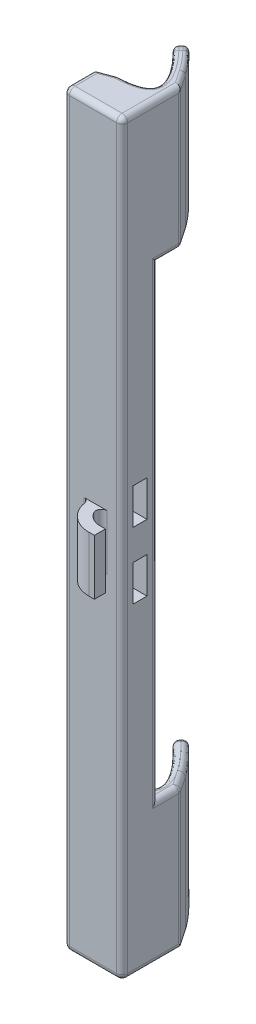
SolidWorks part; units mm, degrees
ref_plane "Front Plane" through (0, 0, 0) normal (0, 0, 1) x (1, 0, 0)
ref_plane "Top Plane" through (0, 0, 0) normal (0, 1, 0) x (1, 0, 0)
ref_plane "Right Plane" through (0, 0, 0) normal (1, 0, 0) x (0, 0, -1)
sketch "Sketch1" plane through (0, 0, 0) normal (0, 1, 0) x (1, 0, 0)
  line L0 (-27.3333, -16.125) -> (-16.8333, -16.125)
  line L1 (-27.3333, -11.625) -> (-27.3333, -16.125) construction
  spline S0 degree 3 poles (-27.3333, -11.625) (-23.339, -11.625) (-16.5111, -11.0911) (-17.6586, -5.246) (-24.4958, 1.1315) knots 0 0 0 0 0.393691 1 1 1 1
  dimension "D1" = 10.5
  dimension "D2" = 4.5
extrude "Extrude-Thin1" add sketch "Sketch1" along normal blind 135 thin contours S0 | L0
ref_plane "Plane1" through (0, 67.5, 0) normal (0, 1, 0) x (1, 0, 0)
sketch "Sketch2" plane through (-27.3333, 0, 0) normal (-1, 0, 0) x (0, 0, 1)
  line L0 (12.625, 135) -> (12.625, 0) construction
  line L1 (12.625, 70.25) -> (15.125, 70.25)
  line L2 (12.625, 70.25) -> (12.625, 64.75)
  line L3 (12.625, 64.75) -> (15.125, 64.75)
  line L4 (15.125, 70.25) -> (15.125, 64.75)
  line L5 (15.125, 135) -> (15.125, 0) construction
  line L6 (15.125, 135) -> (15.125, 0) construction
  line L7 (12.625, 135) -> (12.625, 0) construction
  point P8 (12.625, 67.5)
  dimension "D1" = 5.5
extrude "Boss-Extrude3" add sketch "Sketch2" against normal up to surface (10.5 mm away)
sketch "Sketch5" plane through (0, 0, 0) normal (0, 1, 0) x (1, 0, 0)
  line L0 (-16.8333, -12.625) -> (-27.3333, -12.625) construction
  line L1 (-16.8333, -12.625) -> (-27.3333, -12.625)
  line L3 (-16.8333, -12.625) -> (-16.8333, -6.625)
  line L4 (-18.7549, -3.7789) -> (-16.8333, -6.625)
  spline S0 degree 3 poles (-1814.0444, 892.9965) (-317.2357, 175.3256) (-50.7727, 34.2337) (-19.3112, -2.9326) (-18.5906, -3.95) (-17.5508, -5.8296) (-17.2282, -6.6939) (-17.0488, -7.9244) (-17.0411, -8.3237) (-17.1401, -9.0906) (-17.2478, -9.4576) (-17.5713, -10.1292) (-17.7862, -10.4326) (-18.2909, -10.9605) (-18.5795, -11.1855) (-19.2079, -11.5685) (-19.5482, -11.7269) (-20.275, -11.9932) (-20.6619, -12.1014) (-21.8972, -12.37) (-22.8208, -12.4759) (-67.5415, -15.229) (-315.344, 57.8314) (-1442.284, -1410.3116) knots -3.900448 -3.900448 -3.900448 -3.900448 0.125 0.125 0.25 0.25 0.375 0.375 0.4375 0.4375 0.5 0.5 0.5625 0.5625 0.625 0.625 0.6875 0.6875 0.75 0.75 0.875 0.875 6.129153 6.129153 6.129153 6.129153 only from (-23.8137, 1.8628) to (-27.3333, -12.625) construction
  spline S1 degree 3 poles (-18.7549, -3.7789) (-18.4966, -4.1614) (-18.269, -4.5313) (-17.5508, -5.8296) (-17.2282, -6.6939) (-17.0488, -7.9244) (-17.0411, -8.3237) (-17.1401, -9.0906) (-17.2478, -9.4576) (-17.5713, -10.1292) (-17.7862, -10.4326) (-18.2909, -10.9605) (-18.5795, -11.1855) (-19.2079, -11.5685) (-19.5482, -11.7269) (-20.275, -11.9932) (-20.6619, -12.1014) (-21.8972, -12.37) (-22.8208, -12.4759) (-24.8992, -12.6039) (-26.054, -12.625) (-27.3333, -12.625) knots 0.202308 0.202308 0.202308 0.202308 0.25 0.25 0.375 0.375 0.4375 0.4375 0.5 0.5 0.5625 0.5625 0.625 0.625 0.6875 0.6875 0.75 0.75 0.875 0.875 1 1 1 1
  dimension "D1" = 6
extrude "Boss-Extrude4" add sketch "Sketch5" along normal up to surface (135 mm away)
chamfer "Chamfer1" distance 3 angle 20 1 edges at (-27.3333, 67.5, 10.625)
sketch "Sketch6" plane through (0, 67.5, 0) normal (0, 1, 0) x (1, 0, 0)
  line L0 (-27.3333, -17.125) -> (-16.8333, -17.125) construction
  line L1 (-17.8333, -21.125) -> (-16.8333, -21.125)
  line L3 (-16.8333, -12.625) -> (-16.8333, -6.625) construction
  arc A0 (-21.8333, -17.125) -> (-17.8333, -21.125) centre (-17.8333, -17.125) ccw
  dimension "D2" = 4
  dimension "D1" = 1
extrude "Extrude-Thin2" add sketch "Sketch6" against normal mid plane 10 thin
fillet "Fillet1" radius 3 2 edges at (-24.4958, 135, -1.1315) (-24.4958, 0, -1.1315)
fillet "Fillet2" radius 0.75 18 edges at (-25.1779, 67.5, -0.4003) (-23.8137, 67.5, -1.8628) (-27.3333, 135, 12.171) (-27.3333, 0, 12.171) (-23.3354, 133.874, -1.4118) (-22.9961, 0.6558, -1.0857) (-24.3604, 134.3444, 0.3773) (-24.6997, 1.126, 0.0508) (-24.1346, 67.5, 10.5527) (-27.3333, 67.5, 11.7169) (-25.734, 0, 11.1348) (-25.734, 135, 11.1348)
fillet "Fillet3" radius 1 5 edges at (-17.053, 0.2197, 6.6922) (-17.053, 134.7803, 6.6922) (-22.8333, 67.5, 17.125) (-20.8333, 67.5, 17.125) (-16.8333, 67.5, 6.625)
sketch "Sketch7" plane through (-27.3333, 0, 0) normal (-1, 0, 0) x (0, 0, 1)
  line L0 (15.125, 135) -> (15.125, 70.25) construction
  line L1 (12.625, 135) -> (15.125, 135)
  line L2 (12.625, 135) -> (12.625, 76.75)
  line L3 (12.625, 76.75) -> (15.125, 76.75)
  line L4 (15.125, 135) -> (15.125, 76.75)
  line L5 (12.625, 64.75) -> (12.625, 0.75) construction
  line L6 (15.125, 0) -> (12.625, 0)
  line L7 (15.125, 0) -> (15.125, 58.25)
  line L8 (15.125, 58.25) -> (12.625, 58.25)
  line L9 (12.625, 0) -> (12.625, 58.25)
  line L10 (13.875, 58.25) -> (13.875, 64.75) construction
  line L11 (12.625, 64.75) -> (15.125, 64.75) construction
  line L12 (13.875, 64.75) -> (13.875, 70.25) construction
  line L13 (15.125, 70.25) -> (12.625, 70.25) construction
  line L14 (13.875, 70.25) -> (13.875, 76.75) construction
  dimension "D1" = 6.5
extrude "Boss-Extrude5" add sketch "Sketch7" against normal up to surface (10.5 mm away)
sketch "Sketch8" plane through (-27.3333, 0, 0) normal (-1, 0, 0) x (0, 0, 1)
  line L0 (-1.5494, 132) -> (-1.5494, 3) construction
  line L1 (-1.5494, 109.5) -> (10.625, 109.5)
  line L2 (-1.5494, 109.5) -> (-1.5494, 25.5)
  line L3 (-1.5494, 25.5) -> (10.625, 25.5)
  line L4 (10.625, 109.5) -> (10.625, 25.5)
  line L6 (-1.5494, 67.5) -> (10.625, 67.5) construction
  line L7 (10.625, 67.5) -> (13.875, 67.5) construction
  line L9 (13.875, 67.5) -> (17.125, 67.5) construction
  line L10 (17.125, 135) -> (17.125, 0) construction
  line L11 (13.875, 64.75) -> (13.875, 70.25) construction
  line L12 (12.625, 64.75) -> (15.125, 64.75) construction
  line L13 (15.125, 70.25) -> (12.625, 70.25) construction
  point P18 (0, 0)
  dimension "D1" = 84
extrude "Cut-Extrude1" cut sketch "Sketch8" against normal through all
fillet "Fillet4" radius 1 58 edges at (-26.5833, 0, 12.4335) (-16.8333, 0.75, 9.778) (-27.1137, 0.2197, 12.625) (-17.053, 0.2197, 12.625) (-27.1137, 134.7803, 12.625) (-17.053, 134.7803, 12.625) (-27.3333, 134.25, 12.4335) (-27.3333, 0.75, 12.4335) (-27.1137, 0.2197, 12.2421) (-27.1137, 134.7803, 12.2421) (-17.5833, 0, 9.778) (-17.5943, 0, 6.8578) (-16.8333, 134.25, 9.778) (-17.053, 134.7803, 6.931) (-17.5943, 135, 6.8578) (-17.053, 0.2197, 6.931) (-17.2083, 135, 12.625) (-26.9583, 135, 12.625) (-27.3333, 134.625, 12.625) (-16.8333, 134.625, 12.625) (-17.2083, 0, 12.625) (-26.9583, 0, 12.625) (-27.3333, 0.375, 12.625) (-16.8333, 0.375, 12.625) (-16.8771, 25.5, 6.6384) (-16.8771, 109.5, 6.6384) (-24.6396, 14.25, 0.1082) (-24.6695, 120.75, -0.9453) (-24.2856, 109.5, 10.6076) (-24.1336, 109.5, 10.5606) (-24.8708, 109.5, -0.4124) (-24.499, 109.5, -1.1281) (-23.8013, 109.5, -1.5491) (-24.1336, 25.5, 10.5606) (-24.2856, 25.5, 10.6076) (-23.8013, 25.5, -1.5491) (-24.499, 25.5, -1.1281) (-24.8708, 25.5, -0.4124) (-16.8333, 109.5, 8.778) (-17.8797, 109.5, 5.0752) (-16.8333, 67.5, 10.625) (-17.8797, 25.5, 5.0752) (-16.8333, 25.5, 8.778) (-22.0833, 0, 17.125) (-27.3333, 67.5, 17.125) (-16.8333, 135, 14.875) (-16.8333, 67.5, 17.125) (-27.3333, 135, 14.875) (-22.0833, 135, 17.125) (-27.3333, 0, 14.875) (-16.8333, 0, 14.875) (-26.5833, 135, 12.4335) (-17.5833, 135, 9.778)
